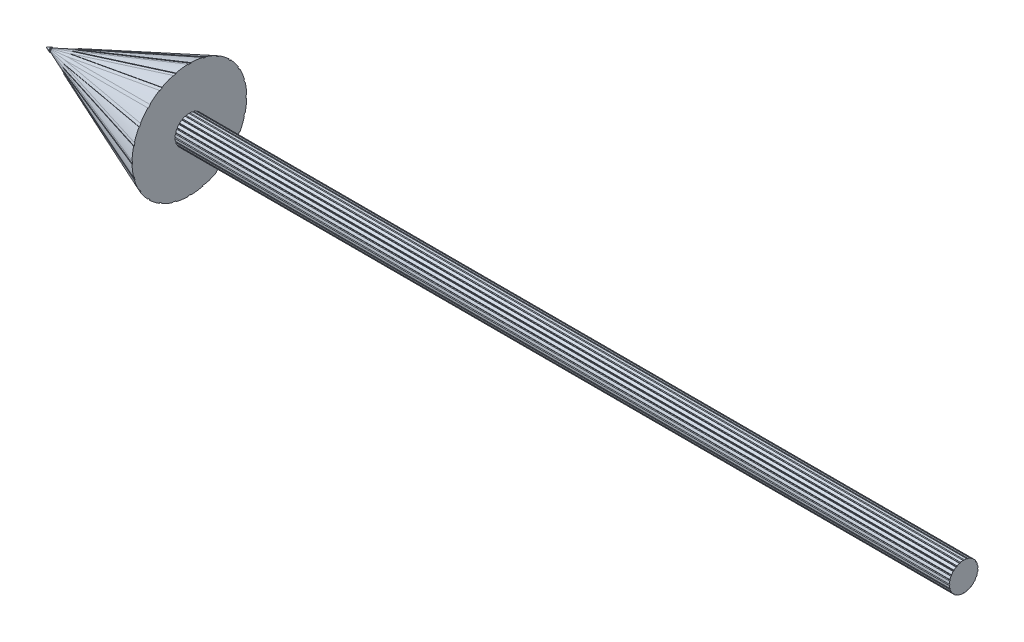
SolidWorks part; units mm, degrees
ref_plane "Face" through (0, 0, 0) normal (0, 0, 1) x (1, 0, 0)
ref_plane "Dessus" through (0, 0, 0) normal (0, 1, 0) x (1, 0, 0)
ref_plane "Droite" through (0, 0, 0) normal (1, 0, 0) x (0, 0, -1)
sketch "Esquisse1" plane through (0, 0, 0) normal (1, 0, 0) x (0, 0, -1)
  circle A0 centre (0, 0) radius 0.5
  dimension "D1" = 1
extrude "Boss.-Extru.1" add sketch "Esquisse1" along normal blind 27
sketch "Esquisse2" plane through (0, 0, 0) normal (0, 0, 1) x (1, 0, 0)
  line L0 (0, 0) -> (-11.2925, 0) construction
  line L1 (0, 0) -> (0, 2)
  line L2 (0, 2) -> (-5, 0)
  line L3 (-5, 0) -> (0, 0)
  dimension "D1" = 5
  dimension "D2" = 4
revolve "Révolution1" add sketch "Esquisse2" angle 360 about L0
sketch "Esquisse3" plane through (27, 0, 0) normal (1, 0, 0) x (0, 0, -1)
  line L0 (0, 0.48) -> (-0.05, 0.53)
  line L1 (-0.05, 0.53) -> (0.05, 0.53)
  line L2 (0.05, 0.53) -> (0, 0.48)
  line L3 (0, 0) -> (0, 0.48) construction
  dimension "D1" = 0.1
  dimension "D2" = 0.48
  dimension "D3" = 90
extrude "Enlèv. mat.-Extru.1" cut sketch "Esquisse3" against normal up to surface (27 mm away)
pattern_circular "Répétition circulaire1" count 24 over 360 about axis through (0, 0, 0) along (1, 0, 0) of "Enlèv. mat.-Extru.1"
sketch "Esquisse4" plane through (0, 0, 0) normal (0, 0, 1) x (1, 0, 0)
  line L0 (0, 1.9785) -> (-4.7721, 0.0696)
  line L1 (-4.7721, 0.0696) -> (-4.826, 0.0696)
  line L2 (0, 2) -> (-5, 0) construction
  line L3 (-4.826, 0.0696) -> (0, 2)
  line L4 (0, 2) -> (0, 1.9785)
  line L8 (0, 0.0196) -> (-6.1417, 0.0196) construction
  dimension "D1" = 0.02
  dimension "D2" = 0.05
extrude "Enlèv. mat.-Extru.2" cut sketch "Esquisse4" against normal mid plane 0.1
pattern_circular "Répétition circulaire2" count 24 over 360 about axis through (0, 0, 0) along (1, 0, 0) of "Enlèv. mat.-Extru.2"
